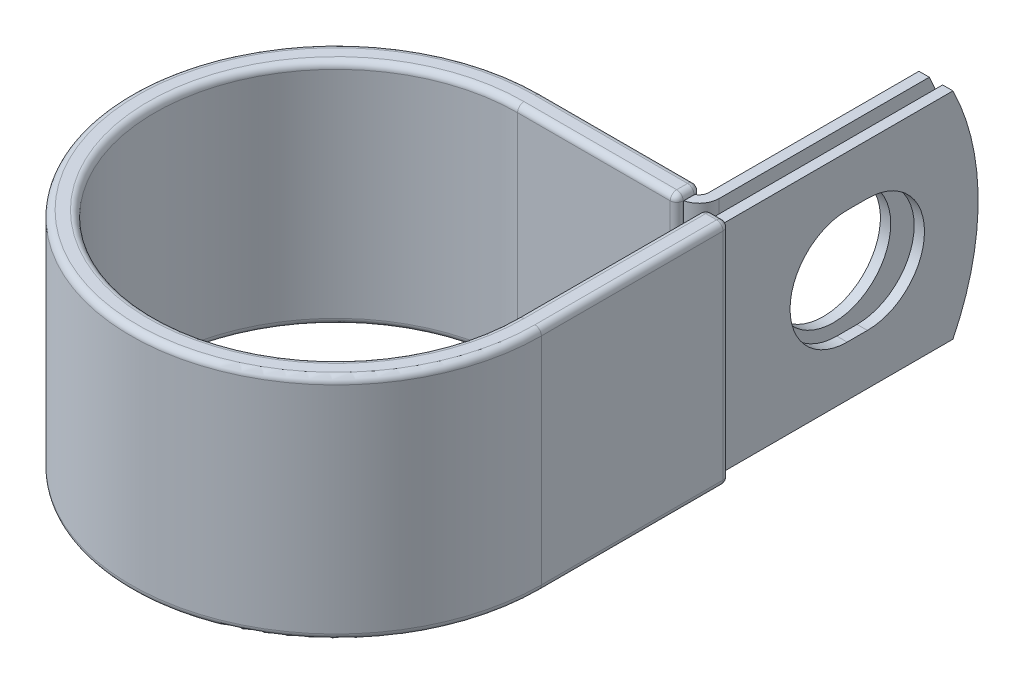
SolidWorks part; units mm, degrees
ref_plane "Front Plane" through (0, 0, 0) normal (0, 0, 1) x (1, 0, 0)
ref_plane "Top Plane" through (0, 0, 0) normal (0, 1, 0) x (1, 0, 0)
ref_plane "Right Plane" through (0, 0, 0) normal (1, 0, 0) x (0, 0, -1)
sketch "Sketch1" plane through (0, 0, 0) normal (0, 1, 0) x (1, 0, 0)
  line L0 (0, 22.2187) -> (18.2664, 22.2187)
  line L1 (22.2187, 0) -> (22.2187, 22.2187)
  line L2 (20.6438, 52.3748) -> (20.6438, 24.5961)
  line L5 (22.2187, 22.2187) -> (22.2187, 52.3748)
  arc A0 (0, 22.2187) -> (22.2187, 0) centre (0, 0) ccw
  arc A3 (18.2664, 22.2187) -> (20.6438, 24.5961) centre (18.2664, 24.5961) ccw
extrude "Extrude-Thin1" add sketch "Sketch1" along normal mid plane 25.4 thin
sketch "Sketch2" plane through (19.4246, 0, 0) normal (-1, 0, 0) x (0, 0, 1)
  line L0 (-52.3748, 12.7) -> (-52.3748, -12.7) construction
  line L7 (0, 12.7) -> (0, -12.7) construction
  circle A0 centre (-38.1, 0) radius 6.7437
  point P2 (-52.3748, 0)
extrude "Cut-Extrude1" cut sketch "Sketch2" against normal up to surface (1.2192 mm away)
sketch "Sketch3" plane through (23.4379, 0, 0) normal (1, 0, 0) x (0, 0, -1)
  line L0 (36.9062, 0) -> (39.2938, 0) construction
  line L1 (36.9062, 6.7437) -> (39.2938, 6.7437)
  line L2 (36.9062, -6.7437) -> (39.2938, -6.7437)
  line L3 (52.3748, 12.7) -> (52.3748, -12.7) construction
  arc A0 (36.9062, 6.7437) -> (36.9062, -6.7437) centre (36.9062, 0) ccw
  arc A1 (39.2938, -6.7437) -> (39.2938, 6.7437) centre (39.2938, 0) ccw
  point P3 (38.1, 0)
  point P8 (52.3748, 0)
  point P11 (30.1625, 0)
  point P12 (46.0375, 0)
extrude "Cut-Extrude2" cut sketch "Sketch3" against normal up to surface (1.2192 mm away)
sketch "Sketch4" plane through (19.4246, 0, 0) normal (-1, 0, 0) x (0, 0, 1)
  line L0 (-52.3748, 12.7) -> (-52.3748, -12.7)
  line L1 (-52.3748, 12.7) -> (-49.3975, 12.7)
  line L2 (-52.3748, 12.7) -> (-24.5961, 12.7) construction
  line L3 (-52.3748, -12.7) -> (-49.3975, -12.7)
  line L4 (-52.3748, -12.7) -> (-24.5961, -12.7) construction
  arc A0 (-49.3975, 12.7) -> (-49.3975, -12.7) centre (-23.7998, 0) ccw
extrude "Cut-Extrude3" cut sketch "Sketch4" against normal through all contours A0 M4 M5 | A0 L0 M2
ref_plane "Plane1" through (0, 0, -22.2187) normal (0, 0, 1) x (1, 0, 0)
ref_plane "Plane2" through (0, 0, 0) normal (-1, 0, 0) x (0, 0, 1)
sketch "Sketch5" plane through (0, 0, -22.2187) normal (0, 0, 1) x (1, 0, 0)
  line L0 (22.2187, 12.7) -> (23.4379, 12.7)
  line L1 (22.2187, -12.7) -> (22.2187, 12.7)
  line L2 (21.4249, -12.7317) -> (21.4249, 12.7317)
  line L3 (23.4379, 12.7) -> (23.4379, -12.7)
  line L4 (23.4379, -12.7) -> (22.2187, -12.7)
  line L5 (22.1869, 13.4937) -> (23.4696, 13.4937)
  line L7 (24.2316, 12.7317) -> (24.2316, -12.7317)
  line L8 (23.4696, -13.4937) -> (22.1869, -13.4937)
  line L9 (21.4249, -13.4937) -> (21.4249, 13.4937) construction
  line L11 (24.2316, -13.4937) -> (21.4249, -13.4937) construction
  line L12 (24.2316, 13.4937) -> (24.2316, -13.4937) construction
  line L13 (21.4249, 13.4937) -> (24.2316, 13.4937) construction
  arc A0 (21.4249, -12.7317) -> (22.1869, -13.4937) centre (22.1869, -12.7317) ccw
  arc A1 (24.2316, -12.7317) -> (23.4696, -13.4937) centre (23.4696, -12.7317) cw
  arc A2 (21.4249, 12.7317) -> (22.1869, 13.4937) centre (22.1869, 12.7317) cw
  arc A3 (23.4696, 13.4937) -> (24.2316, 12.7317) centre (23.4696, 12.7317) cw
sketch "Sketch6" plane through (0, 12.7, 0) normal (0, 1, 0) x (1, 0, 0)
  line L0 (21.4249, 0) -> (21.4249, 22.2187)
  line L1 (0, 21.4249) -> (18.7896, 21.4249)
  line L2 (19.4246, 49.3975) -> (19.4246, 24.5961) construction
  arc A0 (0, 21.4249) -> (21.4249, 0) centre (0, 0) ccw
sweep "Sweep1" add profiles "Sketch5" path "Sketch6"
fillet "Fillet1" radius 0.762 16 edges at (18.7897, 13.2706, -24.0084) (18.7897, 0, -24.2316) (18.7897, -13.2706, -24.0084) (18.7897, -13.4937, -22.8283) (18.7897, -13.2706, -21.6481) (18.7897, 0, -21.4249) (18.7897, 13.2706, -21.6481) (24.0084, 13.2706, -22.2187) (24.2316, 0, -22.2187) (24.0084, -13.2706, -22.2187) (22.8283, -13.4937, -22.2187) (21.6481, -13.2706, -22.2187) (21.4249, 0, -22.2187) (21.6481, 13.2706, -22.2187) (18.7897, 13.4937, -22.8283) (22.8283, 13.4937, -22.2187)
equation "\"D4@Sketch5\" = \"D1@Extrude-Thin1\""
equation "\"D5@Sketch5\" = \"D5@Extrude-Thin1\""
equation "\"D1@Sketch3\" = \"D2@Sketch2\""
equation "\"D7@Sketch1\" = \"D3@Sketch2\" + \"D1@Sketch3\""
equation "\"D1@Sketch1\" = \"D1@Sketch6\" + 2 * \"D3@Sketch5\""
equation "\"D1@Sketch4\" = ( \"D1@Extrude-Thin1\" + .125 ) * 2"
equation "\"D2@Sketch1\"=1.95*\"D5@Extrude-Thin1\""
equation "\"D2@Sketch3\" = \"D1@Sketch2\""
